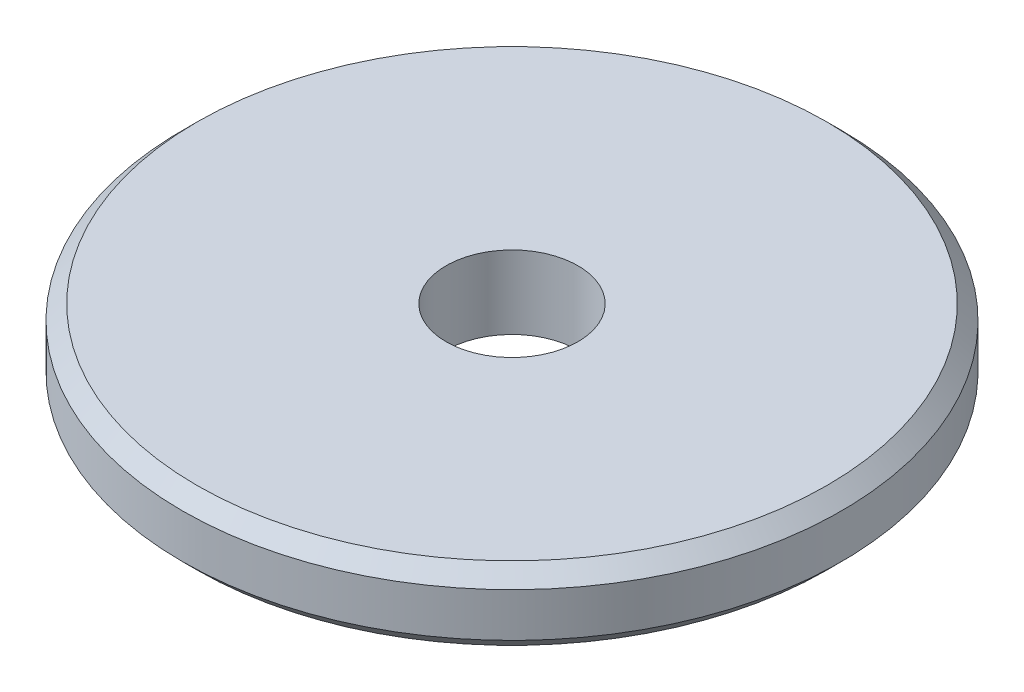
SolidWorks part; units mm, degrees
ref_plane "Front Plane" through (0, 0, 0) normal (0, 0, 1) x (1, 0, 0)
ref_plane "Top Plane" through (0, 0, 0) normal (0, 1, 0) x (1, 0, 0)
ref_plane "Right Plane" through (0, 0, 0) normal (1, 0, 0) x (0, 0, -1)
sketch "Sketch1" plane through (0, 0, 0) normal (0, 1, 0) x (1, 0, 0)
  circle A0 centre (0, 0) radius 22.5
  circle A1 centre (0, 0) radius 4.5
  dimension "D1" = 9
  dimension "D2" = 45
extrude "Extrude1" add sketch "Sketch1" along normal blind 5
chamfer "Chamfer1" distance 1 angle 45 2 edges at (0, 0, 22.5) (0, 5, 22.5)
